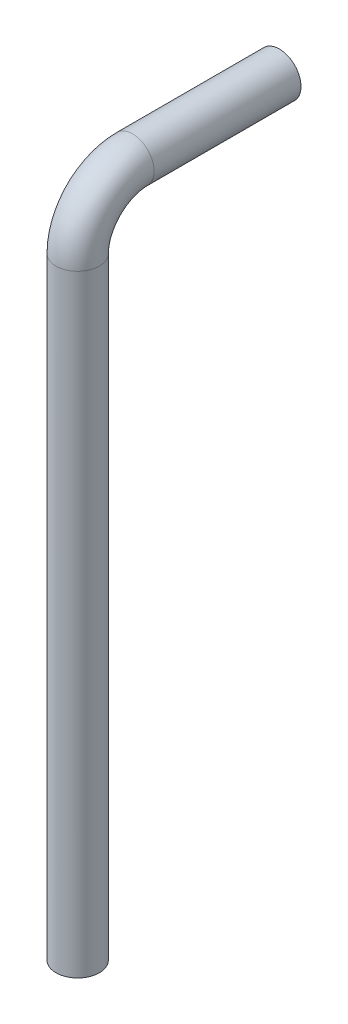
SolidWorks part; units mm, degrees
ref_plane "Plan1" through (0, 0, 0) normal (0, 0, 1) x (1, 0, 0)
ref_plane "Plan2" through (0, 0, 0) normal (0, 1, 0) x (1, 0, 0)
ref_plane "Plan3" through (0, 0, 0) normal (1, 0, 0) x (0, 0, -1)
sketch "Esquisse1" plane through (0, 0, 0) normal (1, 0, 0) x (0, 0, -1)
  line L0 (0, 0) -> (-204, 0)
  line L1 (-280, -76) -> (-280, -926)
  arc A0 (-204, 0) -> (-280, -76) centre (-204, -76) ccw
  dimension "D1" = 76
  dimension "D2" = 204
  dimension "D3" = 280
  dimension "D4" = 850
sketch "Esquisse2" plane through (0, 0, 0) normal (0, 0, 1) x (1, 0, 0)
  circle A0 centre (0, 0) radius 30.15
  circle A1 centre (0, 0) radius 28.15
  dimension "D1" = 60.3
  dimension "D2" = 2
sweep "Balayage1" add profiles "Esquisse2" path "Esquisse1"
